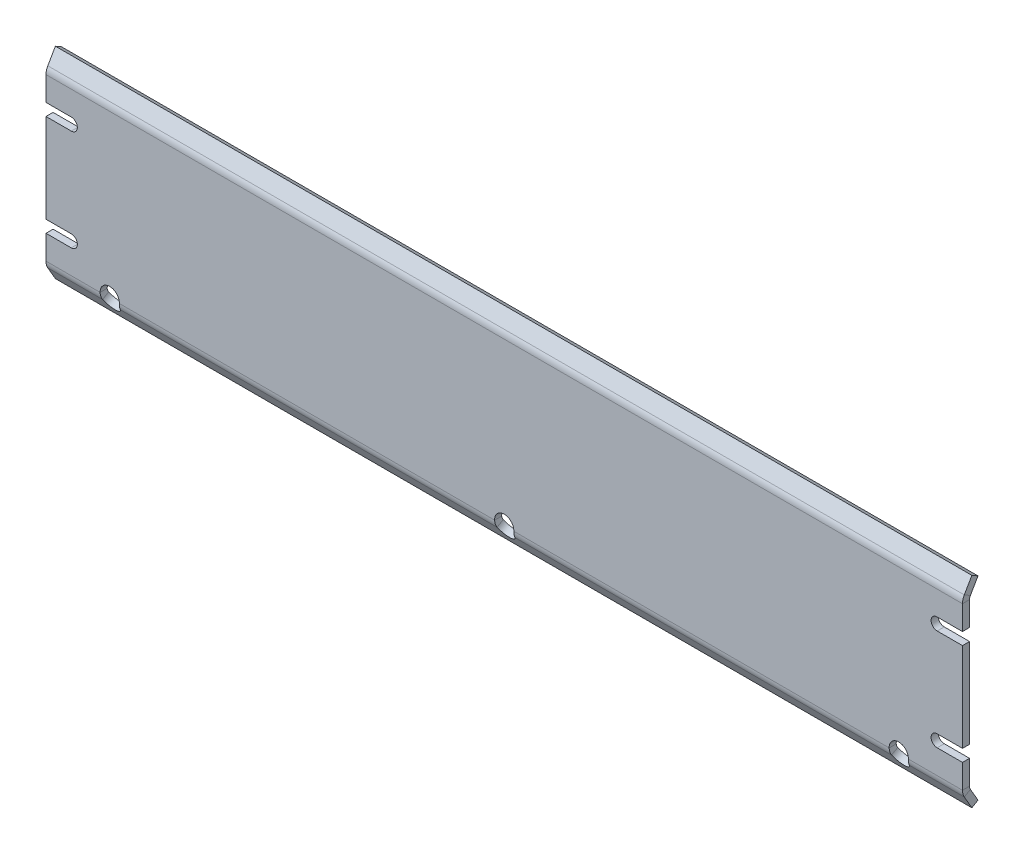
SolidWorks part; units mm, degrees
ref_plane "Plane1" through (0, 0, 0) normal (0, 0, 1) x (1, 0, 0)
ref_plane "Plane2" through (0, 0, 0) normal (0, 1, 0) x (1, 0, 0)
ref_plane "Plane3" through (0, 0, 0) normal (1, 0, 0) x (0, 0, -1)
sketch "Sketch4" plane through (0, 0, 0) normal (1, 0, 0) x (0, 0, -1)
  line L0 (0, 0) -> (-41.656, 0) construction
  line L1 (0, -20.7105) -> (0, 20.7105)
  line L2 (0, 20.7105) -> (2.1209, 24.384)
  line L3 (-1.778, 21.1869) -> (0.5811, 25.273)
  line L4 (-1.778, -21.1869) -> (-1.778, 21.1869)
  line L5 (2.1209, 24.384) -> (0.5811, 25.273)
  line L6 (2.1209, -24.384) -> (0.5811, -25.273)
  line L7 (-1.778, -21.1869) -> (0.5811, -25.273)
  line L8 (0, -20.7105) -> (2.1209, -24.384)
  point P11 (-1.778, 0)
  dimension "D2" = 1.778
  dimension "D3" = 30
  dimension "D4" = 4.2418
  dimension "D5" = 48.768
extrude "Base-Extrude" add sketch "Sketch4" along normal blind 230.124
sheet metal parameters "Sheet-Metal1" thickness 1.778 parameters "D1"=1.6002
bend "SharpBend2" bend angle 30 parameters "D1"=0, "D5"=1
flatten bends "Flatten-Bends1" parameters "D1"=0
sketch "Sharp-Sketch1" plane through (0, 0, 0) normal (0, 0, -1) x (-1, 0, 0)
  line L0 (-230.124, -20.9334) -> (0, -20.9334) construction
  line L1 (0, 20.9334) -> (-230.124, 20.9334) construction
bend "SharpBend1" bend angle 30 parameters "D1"=0, "D5"=2
sketch "Sketch8" plane through (0, 0, 1.778) normal (0, 0, 1) x (1, 0, 0)
  line L0 (0, 14.224) -> (6.35, 14.224)
  line L1 (0, 20.2817) -> (0, -20.2817) construction
  line L2 (0, 11.176) -> (6.35, 11.176)
  line L3 (0, 0) -> (14.732, 0) construction
  line L4 (0, -11.176) -> (6.35, -11.176)
  line L5 (0, -14.224) -> (6.35, -14.224)
  line L6 (0, 14.224) -> (0, 11.176)
  line L7 (0, -11.176) -> (0, -14.224)
  line L8 (115.062, 25.3981) -> (115.062, -25.3981) construction
  line L9 (230.124, 25.3981) -> (0, 25.3981) construction
  line L10 (230.124, -25.3981) -> (0, -25.3981) construction
  line L11 (230.124, -11.176) -> (230.124, -14.224)
  line L12 (230.124, 14.224) -> (230.124, 11.176)
  line L13 (230.124, -14.224) -> (223.774, -14.224)
  line L14 (230.124, -11.176) -> (223.774, -11.176)
  line L15 (230.124, 11.176) -> (223.774, 11.176)
  line L16 (230.124, 14.224) -> (223.774, 14.224)
  arc A0 (6.35, 14.224) -> (6.35, 11.176) centre (6.35, 12.7) cw
  arc A1 (6.35, -14.224) -> (6.35, -11.176) centre (6.35, -12.7) ccw
  arc A2 (223.774, -14.224) -> (223.774, -11.176) centre (223.774, -12.7) cw
  arc A3 (223.774, 14.224) -> (223.774, 11.176) centre (223.774, 12.7) ccw
  dimension "D3" = 3.048
  dimension "D4" = 7.874
  dimension "D1" = 12.7
  dimension "D2" = 3.048
extrude "Cut-Extrude1" cut sketch "Sketch8" against normal through all
process bends "Process-Bends1" parameters "D1"=0
sketch "Flat-Sketch1" plane through (0, 0, 0) normal (0, 0, -1) x (-1, 0, 0)
sketch "Sketch9" plane through (0, 0, 0) normal (0, 0, 1) x (1, 0, 0)
  circle A0 centre (16.002, -20.193) radius 2.413
  circle A1 centre (214.122, -20.193) radius 2.413
  circle A2 centre (115.062, -20.193) radius 2.413
extrude "Cut-Extrude2" cut sketch "Sketch9" against normal through all and the other way through all
